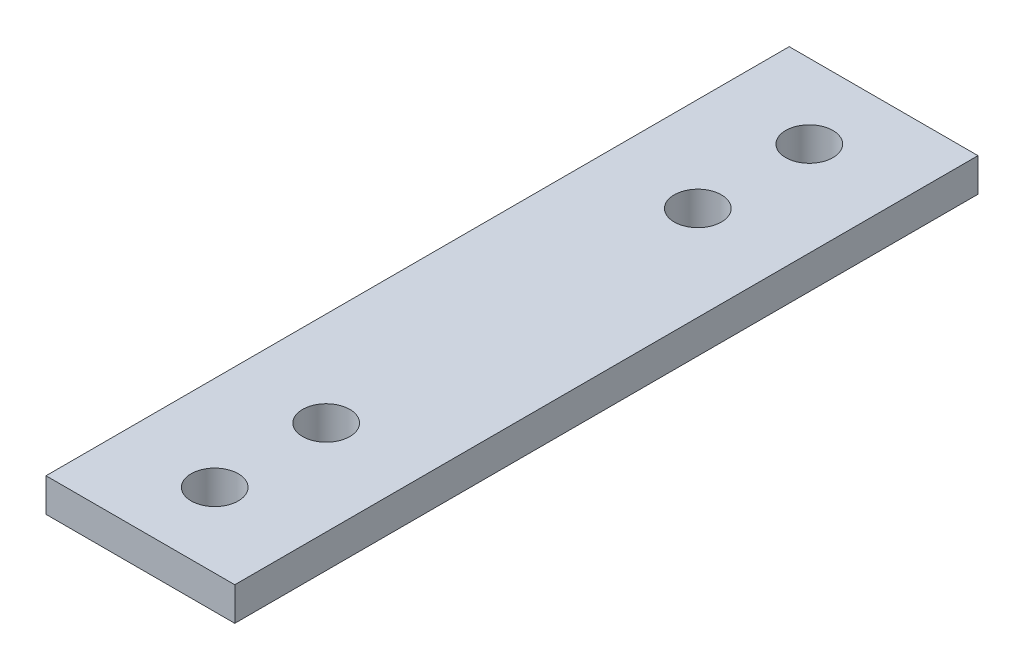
SolidWorks part; units mm, degrees
ref_plane "Alzado" through (0, 0, 0) normal (0, 0, 1) x (1, 0, 0)
ref_plane "Planta" through (0, 0, 0) normal (0, 1, 0) x (1, 0, 0)
ref_plane "Vista lateral" through (0, 0, 0) normal (1, 0, 0) x (0, 0, -1)
sketch "Croquis1" plane through (0, 0, 0) normal (0, 1, 0) x (1, 0, 0)
  line L0 (-55, 0) -> (55, 0) construction
  line L1 (-12.7, 0) -> (12.7, 0)
  line L2 (-12.7, 0) -> (-12.7, -100)
  line L3 (-12.7, -100) -> (12.7, -100)
  line L4 (12.7, 0) -> (12.7, -100)
  line L5 (0, -55) -> (0, 55) construction
  dimension "D1" = 25.4
  dimension "D2" = 12.7
  dimension "D3" = 100
extrude "Extruir1" add sketch "Croquis1" along normal blind 4.5
sketch "Croquis2" plane through (0, 4.5, 0) normal (0, 1, 0) x (-1, 0, 0)
  line L0 (0, 55) -> (0, -55) construction
  line L3 (12.7, 100) -> (-12.7, 100) construction
  line L4 (55, 0) -> (-55, 0) construction
  circle A0 centre (0, 90) radius 3.175
  circle A1 centre (0, 75) radius 3.175
  circle A2 centre (0, 25) radius 3.175
  circle A3 centre (0, 10) radius 3.175
  dimension "D1" = 10
  dimension "D2" = 15
  dimension "D4" = 15
  dimension "D3" = 10
extrude "Cortar-Extruir1" cut sketch "Croquis2" against normal up to next
